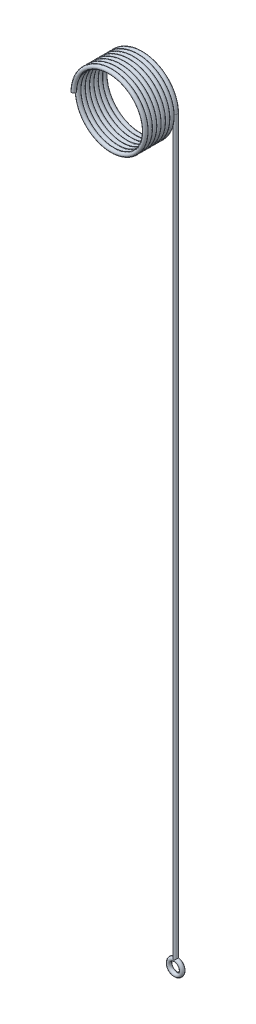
SolidWorks part; units mm, degrees
ref_plane "Спереди" through (0, 0, 0) normal (0, 0, 1) x (1, 0, 0)
ref_plane "Сверху" through (0, 0, 0) normal (0, 1, 0) x (1, 0, 0)
ref_plane "Справа" through (0, 0, 0) normal (1, 0, 0) x (0, 0, -1)
sketch "Эскиз1" plane through (0, 0, 0) normal (0, 0, 1) x (1, 0, 0)
  circle A0 centre (0, 0) radius 8.5
  dimension "D1" = 17
curve "Спираль1"
sketch "Эскиз2" plane through (0, 0, 0) normal (0, 1, 0) x (1, 0, 0)
  circle A0 centre (-8.5, 0) radius 0.5
  dimension "D1" = 1
sweep "По траектории1" add profiles "Эскиз2" path "Спираль1"
sketch "Эскиз3" plane through (0, 0, 0) normal (0, 1, 0) x (1, 0, 0)
  circle A1 centre (8.5, 8) radius 0.5
  circle A2 centre (8.5, 8) radius 0.5
  dimension "D1" = 0
extrude "Бобышка-Вытянуть1" add sketch "Эскиз3" against normal blind 180
ref_plane "Плоскость1" through (0, 0, -8) normal (0, 0, 1) x (1, 0, 0)
sketch "Эскиз4" plane through (0, 0, -8) normal (0, 0, 1) x (1, 0, 0)
  line L0 (8, -180) -> (9, -180) construction
  line L1 (8.5, -181.6) -> (8.5, -180) construction
  line L2 (8, -180) -> (9, -180) construction
  circle A0 centre (8.5, -181.6) radius 1.6
  dimension "D2" = 3.2
ref_plane "Плоскость2" through (0, -181.6, 0) normal (0, 1, 0) x (-1, 0, 0)
sketch "Эскиз5" plane through (0, -181.6, 0) normal (0, 1, 0) x (-1, 0, 0)
  circle A0 centre (-6.9, -8) radius 0.5
  dimension "D1" = 1
sweep "По траектории2" add profiles "Эскиз5" path "Эскиз4"
